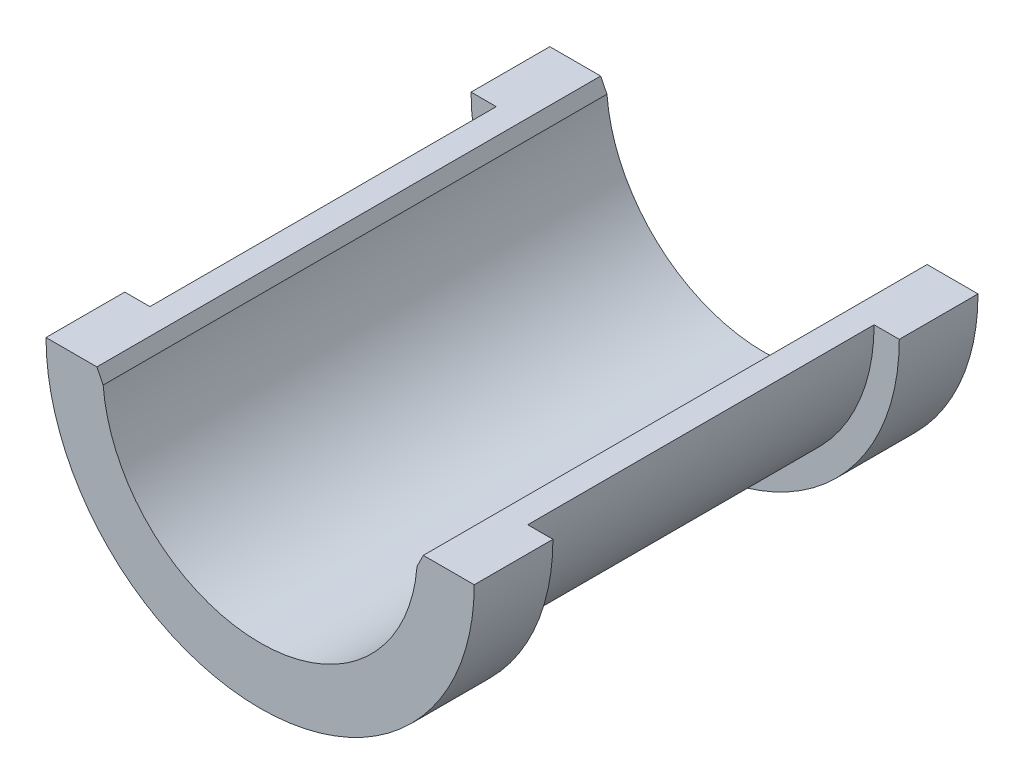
SolidWorks part; units mm, degrees
ref_plane "前视基准面" through (0, 0, 0) normal (0, 0, 1) x (1, 0, 0)
ref_plane "上视基准面" through (0, 0, 0) normal (0, 1, 0) x (1, 0, 0)
ref_plane "右视基准面" through (0, 0, 0) normal (1, 0, 0) x (0, 0, -1)
sketch "草图1" plane through (0, 0, 0) normal (0, 0, 1) x (1, 0, 0)
  line L0 (-25, 70) -> (-30, 70)
  line L1 (30, 70) -> (25, 70)
  arc A2 (-30, 70) -> (30, 70) centre (0, 70) ccw
  arc A3 (25, 70) -> (-25, 70) centre (0, 70) cw
  dimension "D1" = 30
  dimension "D2" = 25
  dimension "D3" = 70
extrude "拉伸1" add sketch "草图1" along normal mid plane 80
sketch "草图2" plane through (0, 0, 40) normal (0, 0, 1) x (1, 0, 0)
  line L0 (-25, 70) -> (-34, 70)
  line L1 (34, 70) -> (25, 70)
  arc A0 (-34, 70) -> (34, 70) centre (0, 70) ccw
  arc A1 (25, 70) -> (-25, 70) centre (0, 70) cw
extrude "拉伸2" add sketch "草图2" along normal up to surface (12.5 mm away)
sketch "草图3" plane through (0, 0, -40) normal (0, 0, -1) x (-1, 0, 0)
  line L0 (-25, 70) -> (-34, 70)
  line L1 (34, 70) -> (25, 70)
  arc A0 (-34, 70) -> (34, 70) centre (0, 70) ccw
  arc A1 (25, 70) -> (-25, 70) centre (0, 70) cw
extrude "拉伸3" add sketch "草图3" against normal up to surface (12.5 mm away)
sketch "草图4" plane through (0, 0, 40) normal (0, 0, 1) x (1, 0, 0)
  line L0 (-25.9199, 70) -> (-24.9199, 68)
  line L1 (-25, 70) -> (-34, 70) construction
  line L2 (-24.9199, 68) -> (-24.9199, 70)
  line L3 (-24.9199, 70) -> (-25.9199, 70)
  arc A0 (-25, 70) -> (25, 70) centre (0, 70) ccw construction
  dimension "D1" = 2
  dimension "D2" = 1
extrude "切除-拉伸1" cut sketch "草图4" against normal through all
mirror "镜向1" about plane through (0, 0, 0) normal (1, 0, 0) of "切除-拉伸1"
